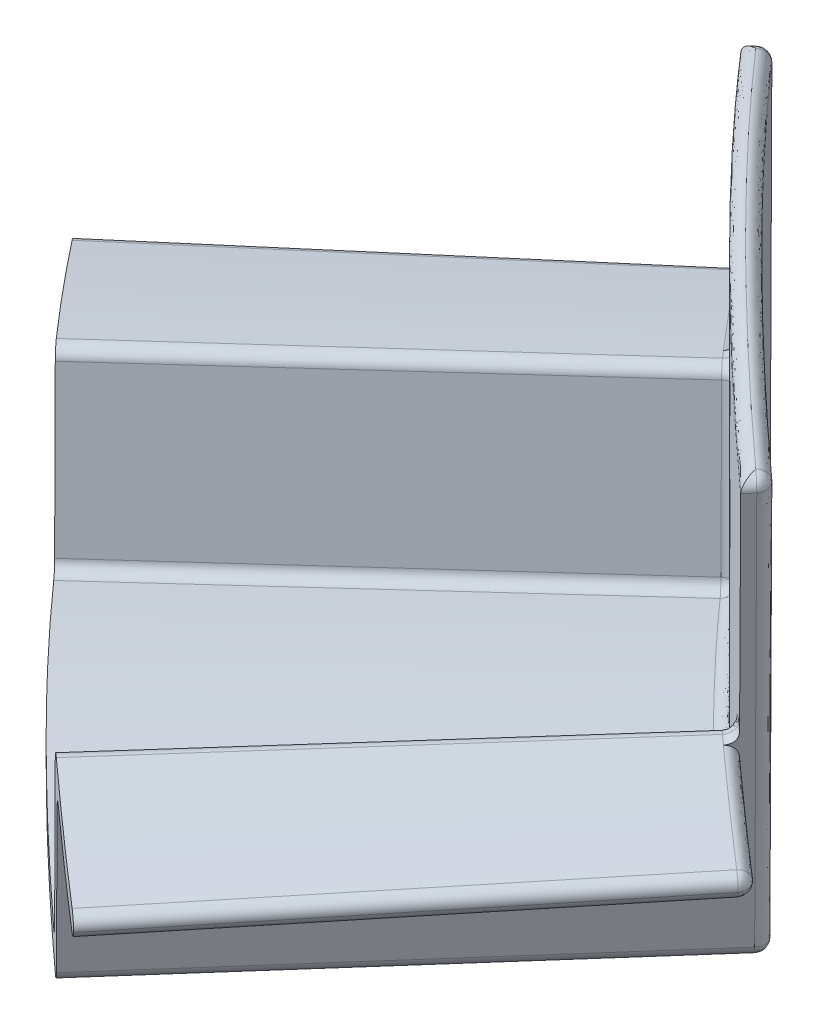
SolidWorks part; units mm, degrees
ref_plane "Front" through (0, 0, 0) normal (0, 0, 1) x (1, 0, 0)
ref_plane "Top" through (0, 0, 0) normal (0, 1, 0) x (1, 0, 0)
ref_plane "Right" through (0, 0, 0) normal (1, 0, 0) x (0, 0, -1)
sketch "Sketch1" plane through (0, 0, 0) normal (0, 1, 0) x (1, 0, 0)
  circle A0 centre (0, 0) radius 2.5
extrude "Extrude1" add sketch "Sketch1" along normal blind 5
sketch "Sketch2" plane through (0, 0, 0) normal (0, -1, 0) x (1, 0, 0)
  circle A0 centre (0, 0) radius 1.5
extrude "Cut-Extrude1" cut sketch "Sketch2" against normal blind 3
sketch "Sketch3" plane through (0, 5, 0) normal (0, 1, 0) x (-1, 0, 0)
  line L0 (0, -15) -> (-15, 0)
  line L1 (-15, 0) -> (0, 15)
  line L2 (0, 15) -> (15, 0)
  line L3 (15, 0) -> (0, -15)
extrude "Extrude2" add sketch "Sketch3" along normal blind 1
sketch "Sketch4" plane through (0, 6, 0) normal (0, 1, 0) x (-1, 0, 0)
  line L0 (0, 15) -> (-15, 0)
  line L1 (-15, 0) -> (-14.2929, -0.7071)
  line L2 (-15, 0) -> (0, -15) construction
  line L3 (-14.2929, -0.7071) -> (0.7071, 14.2929)
  line L4 (15, 0) -> (0, 15) construction
  line L5 (0.7071, 14.2929) -> (0, 15)
  line L7 (14.2929, 0.7071) -> (15, 0)
  line L8 (-0.7071, -14.2929) -> (14.2929, 0.7071)
  line L9 (0, -15) -> (-0.7071, -14.2929)
  line L10 (15, 0) -> (0, -15)
extrude "Extrude3" add sketch "Sketch4" along normal blind 7
sketch "Sketch5" plane through (0, 13, 0) normal (0, 1, 0) x (-1, 0, 0)
  line L0 (0.7071, 14.2929) -> (-14.2929, -0.7071)
  line L1 (-14.2929, -0.7071) -> (-19.2929, 4.2929)
  line L2 (-19.2929, 4.2929) -> (-4.2929, 19.2929)
  line L3 (-4.2929, 19.2929) -> (0.7071, 14.2929)
  line L4 (-0.7071, -14.2929) -> (4.2929, -19.2929)
  line L5 (4.2929, -19.2929) -> (19.2929, -4.2929)
  line L6 (19.2929, -4.2929) -> (14.2929, 0.7071)
  line L7 (14.2929, 0.7071) -> (-0.7071, -14.2929)
extrude "Extrude4" add sketch "Sketch5" along normal blind 1
sketch "Sketch6" plane through (7.5, 0, -7.5) normal (0.7071, 0, -0.7071) x (-0.7071, 0, -0.7071)
  line L0 (-10.6066, 5) -> (10.6066, 5)
  line L1 (10.6066, 5) -> (10.6066, 25)
  line L2 (10.6066, 25) -> (-10.6066, 25)
  line L3 (-10.6066, 25) -> (-10.6066, 5)
extrude "Extrude5" add sketch "Sketch6" along normal blind 1
fillet "Fillet1" radius 0.5 8 edges at (-11.7929, 13, -11.7929) (11.7929, 13, 11.7929) (11.7929, 14, 11.7929) (6.7929, 14, 6.7929) (-11.7929, 14, -11.7929) (-6.7929, 14, -6.7929) (-6.7929, 6, -6.7929)
fillet "Fillet2" radius 0.5 4 edges at (-7.5, 13, -7.5) (7.5, 13, 7.5) (7.8536, 5, 7.1464) (-7.1464, 5, -7.8536)
fillet "Fillet3" radius 0.5 5 edges at (15.7071, 15.25, -0.7071) (15.6036, 5.1464, -0.8107) (0.7071, 15.25, -15.7071) (0.8107, 5.1464, -15.6036) (8.2071, 5, -8.2071)
fillet "Fillet4" radius 0.5 9 edges at (14.8232, 14, -0.1768) (14.3964, 13.8536, -0.6036) (14.1893, 6.1464, -0.8107) (0.1768, 14, -14.8232) (0.6036, 13.8536, -14.3964) (0.7071, 10, -14.2929) (0.8107, 6.1464, -14.1893)
fillet "Fillet5" radius 0.5 6 edges at (0.1768, 25, -15.1768) (0.7071, 25, -15.5) (15.1768, 25, -0.1768) (15.5, 25, -0.7071) (8.2071, 25, -8.2071) (7.5, 25, -7.5)
fillet "Fillet7" radius 0.5 5 edges at (-0.1036, 12.8536, -15.1036) (-2.1464, 13, -17.1464) (-4.1893, 13.1464, -19.1893) (-4.1893, 13.8536, -19.1893) (-1.9697, 14, -16.9697)
fillet "Fillet8" radius 0.5 5 edges at (15.1036, 12.8536, 0.1036) (17.1464, 13, 2.1464) (19.1893, 13.1464, 4.1893) (19.1893, 13.8536, 4.1893) (16.9697, 14, 1.9697)
fillet "Fillet10" radius 0.5 1 edges at (0, 5, 2.5)
other "Flex1" parameters "D0"=24, "D1"=0, "D2"=0
